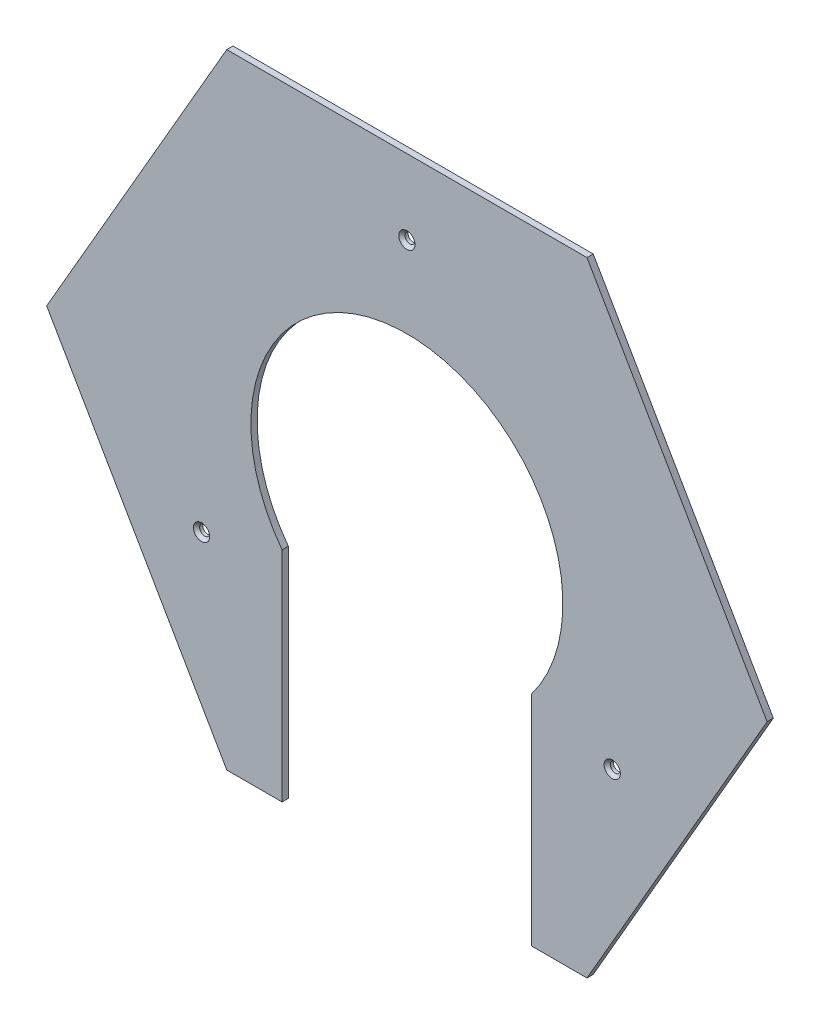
SolidWorks part; units mm, degrees
ref_plane "Front Plane" through (0, 0, 0) normal (0, 0, 1) x (1, 0, 0)
ref_plane "Top Plane" through (0, 0, 0) normal (0, 1, 0) x (1, 0, 0)
ref_plane "Right Plane" through (0, 0, 0) normal (1, 0, 0) x (0, 0, -1)
sketch "Sketch1" plane through (0, 0, 0) normal (0, 0, 1) x (1, 0, 0)
  line L0 (0, 0) -> (0, 100) construction
  line L1 (115.47, 0) -> (57.735, 100)
  line L2 (57.735, 100) -> (-57.735, 100)
  line L3 (-57.735, 100) -> (-115.47, 0)
  line L4 (-115.47, 0) -> (-57.735, -100)
  line L5 (-57.735, -100) -> (-40, -100)
  line L6 (57.735, -100) -> (115.47, 0)
  line L7 (-40, -100) -> (-40, -30)
  line L8 (40, -100) -> (40, -30)
  line L9 (40, -100) -> (57.735, -100)
  line L10 (0, 0) -> (0, 76) construction
  line L11 (0, 0) -> (65.8179, -38) construction
  circle A0 centre (0, 0) radius 115.47 construction
  arc A1 (40, -30) -> (-40, -30) centre (0, 0) ccw
  circle A2 centre (0, 76) radius 1.6
  circle A3 centre (65.8179, -38) radius 1.6
  circle A4 centre (-65.8179, -38) radius 1.6
  dimension "D1" = 230.94
  dimension "D2" = 50
  dimension "D4" = 3.2
  dimension "D5" = 76
  dimension "D7" = 76
  dimension "D8" = 76
  dimension "D3" = 40
  dimension "D6" = 120
sheet metal parameters "Sheet-Metal1" thickness 2 parameters "D1"=1
base flange "Base-Flange1" sketch "Sketch1" thickness 2 reverse thickness direction yes parameters "D1"=1
chamfer "Chamfer1" distance 1 angle 45 3 edges at (67.4179, -38, 2) (-64.2179, -38, 2) (1.6, 76, 2)
flat pattern "Flat-Pattern1"
sketch "Bend-Lines1" plane through (0, 0, 0) normal (0, 1, 0) x (-1, 0, 0)
